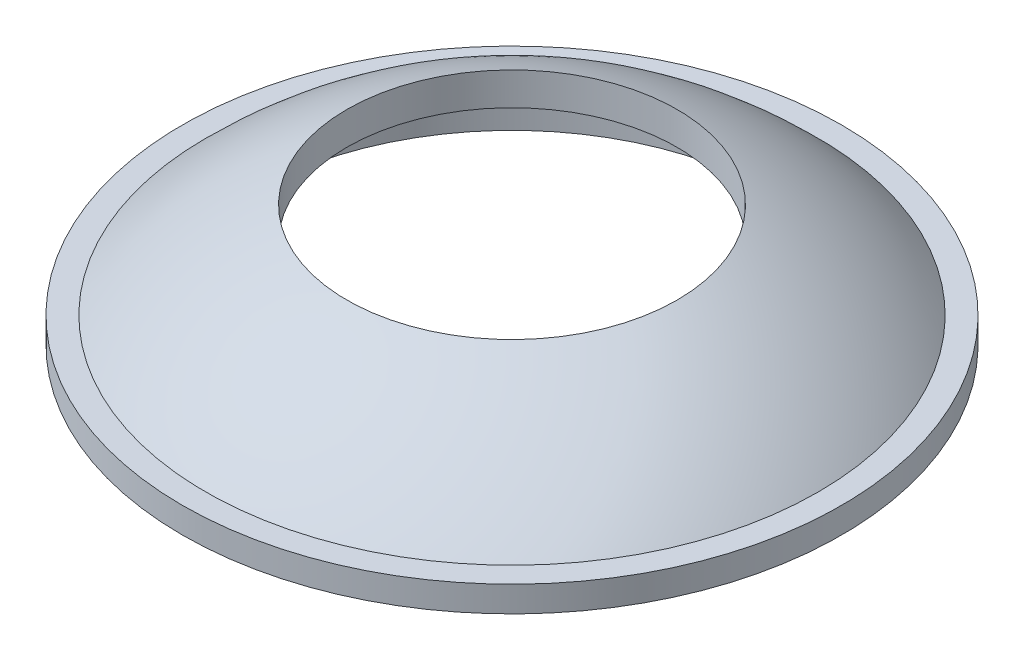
SolidWorks part; units mm, degrees
ref_plane "Front Plane" through (0, 0, 0) normal (0, 0, 1) x (1, 0, 0)
ref_plane "Top Plane" through (0, 0, 0) normal (0, 1, 0) x (1, 0, 0)
ref_plane "Right Plane" through (0, 0, 0) normal (1, 0, 0) x (0, 0, -1)
sketch "Sketch1" plane through (0, 0, 0) normal (0, 0, 1) x (1, 0, 0)
  line L0 (0, 9.3) -> (0, 10)
  line L1 (9.3, 0) -> (10, 0)
  line L2 (0, 0) -> (9.3, 0) construction
  line L3 (0, 0) -> (0, 9.3) construction
  arc A0 (9.3, 0) -> (0, 9.3) centre (0, 0) ccw
  arc A1 (10, 0) -> (0, 10) centre (0, 0) ccw
  arc A2 (0, 9.3) -> (9.3, 0) centre (0, 0) ccw construction
  arc A3 (0, 10) -> (10, 0) centre (0, 0) ccw construction
  dimension "D1" = 18.6
  dimension "D2" = 20
revolve "Revolve1" add sketch "Sketch1" angle 360 about L3
sketch "Sketch2" plane through (0, 0, 0) normal (1, 0, 0) x (0, 0, -1)
  line L1 (14.2354, 6.4) -> (-14.2354, 6.4)
  line L2 (14.2354, 6.4) -> (14.2354, 0)
  line L3 (14.2354, 0) -> (-14.2354, 0)
  line L4 (-14.2354, 6.4) -> (-14.2354, 0)
  dimension "D1" = 28.4707
  dimension "D2" = 6.4
extrude "Cut-Extrude1" cut sketch "Sketch2" against normal blind 14 and the other way blind 13
sketch "Sketch3" plane through (0, 6.4, 0) normal (0, -1, 0) x (1, 0, 0)
  circle A0 centre (0, 0) radius 6.125
  circle A1 centre (0, 0) radius 7.6837
  dimension "D1" = 12.25
  dimension "D2" = 15.3675
extrude "Boss-Extrude1" add sketch "Sketch3" against normal blind 0.6
sketch "Sketch4" plane through (0, 6.4, 0) normal (0, -1, 0) x (1, 0, 0)
  circle A0 centre (0, 0) radius 3.85
  dimension "D1" = 7.7
extrude "Cut-Extrude2" cut sketch "Sketch4" against normal blind 7.3
